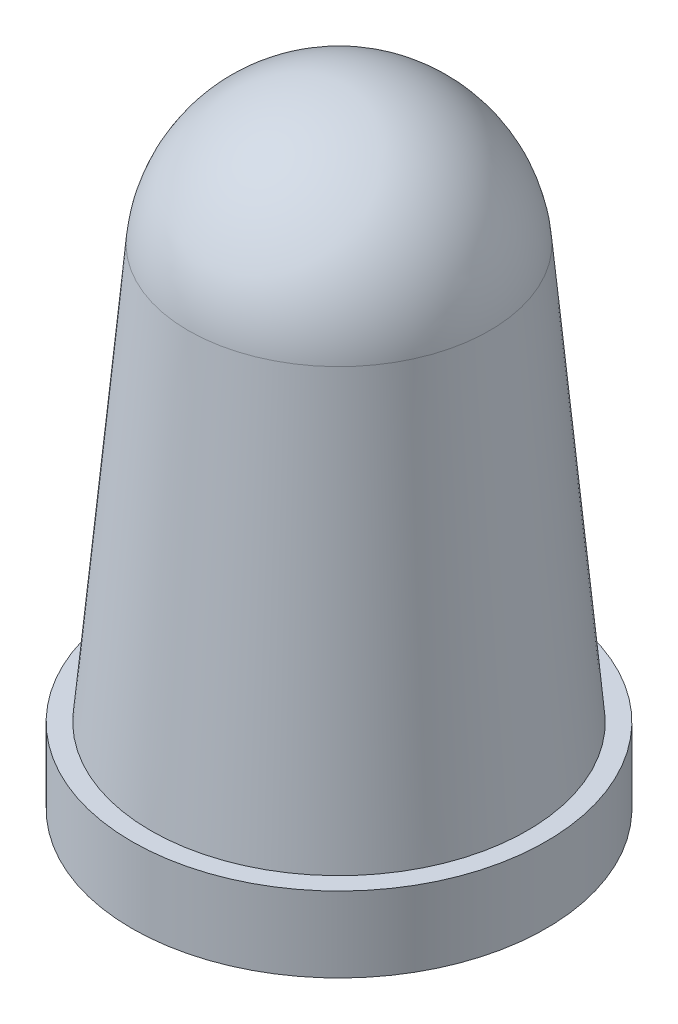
SolidWorks part; units mm, degrees
ref_plane "Plan de face" through (0, 0, 0) normal (0, 0, 1) x (1, 0, 0)
ref_plane "Plan de dessus" through (0, 0, 0) normal (0, 1, 0) x (1, 0, 0)
ref_plane "Plan de droite" through (0, 0, 0) normal (1, 0, 0) x (0, 0, -1)
sketch "Esquisse1" plane through (0, 0, 0) normal (0, 0, 1) x (1, 0, 0)
  line L0 (0, 0) -> (0, 53.6529) construction
  line L1 (0, 0) -> (2.75, 0)
  line L2 (2.75, 0) -> (2.75, 1)
  line L3 (2.75, 1) -> (2.5, 1)
  line L4 (2.5, 1) -> (2, 6.5)
  line L5 (0, 8.3189) -> (0, 0)
  arc A0 (2, 6.5) -> (0, 8.3189) centre (0.0082, 6.3189) ccw
  dimension "D6" = 1.8189
  dimension "D1" = 2.75
  dimension "D2" = 1
  dimension "D3" = 0.25
  dimension "D4" = 6.5
  dimension "D5" = 2
revolve "Révolution1" add sketch "Esquisse1" angle 360 about L0
